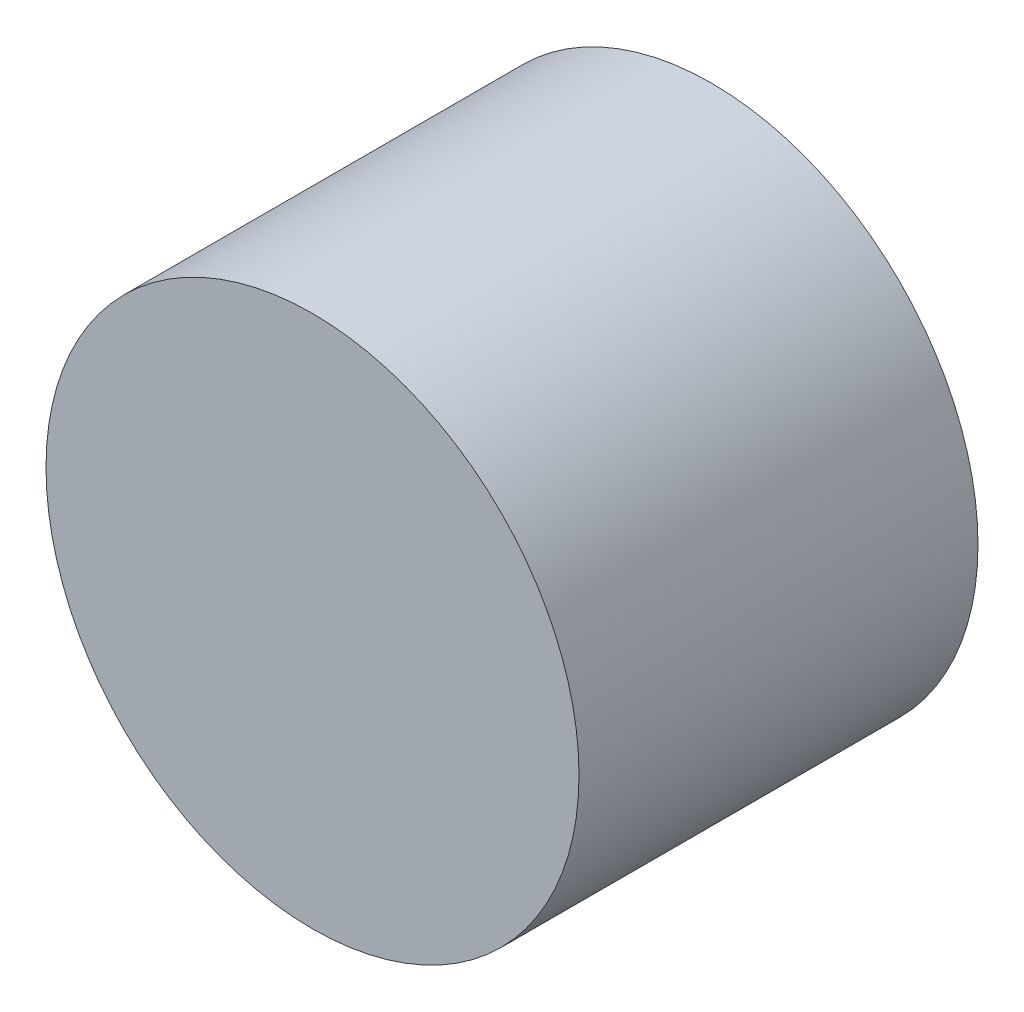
SolidWorks part; units mm, degrees
ref_plane "Front Plane" through (0, 0, 0) normal (1, 0, 0) x (0, 1, 0)
ref_plane "Top Plane" through (0, 0, 0) normal (0, 0, 1) x (0, 1, 0)
ref_plane "Right Plane" through (0, 0, 0) normal (0, 1, 0) x (-1, 0, 0)
sketch "Sketch1" plane through (0, 0, 0) normal (0, 0, 1) x (0, 1, 0)
  circle A0 centre (0, 0) radius 35
  dimension "D1" = 70
extrude "Boss-Extrude1" add sketch "Sketch1" along normal blind 52.4
